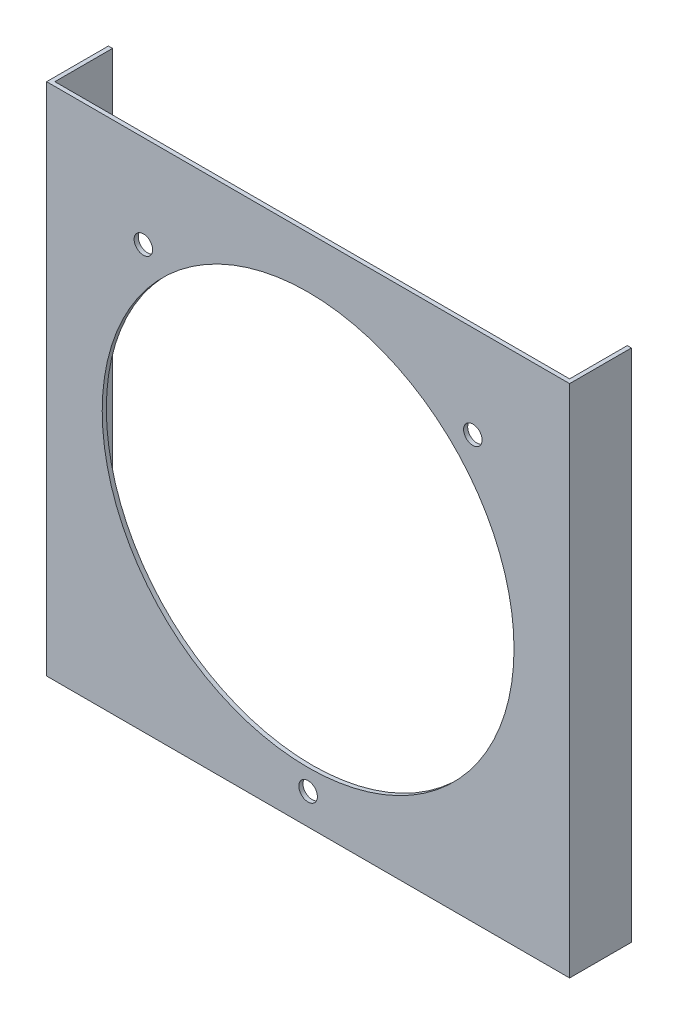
SolidWorks part; units mm, degrees
ref_plane "Piano frontale" through (0, 0, 0) normal (0, 0, 1) x (1, 0, 0)
ref_plane "Piano superiore" through (0, 0, 0) normal (0, 1, 0) x (1, 0, 0)
ref_plane "Piano destro" through (0, 0, 0) normal (1, 0, 0) x (0, 0, -1)
sketch "Schizzo1" plane through (0, 0, 0) normal (0, 0, 1) x (1, 0, 0)
  line L1 (-125, -125) -> (125, -125)
  line L2 (-125, -125) -> (-125, 125)
  line L3 (-125, 125) -> (125, 125)
  line L4 (125, -125) -> (125, 125)
  line L5 (-125, -125) -> (125, 125) construction
  line L6 (-125, 125) -> (125, -125) construction
  circle A1 centre (0, 0) radius 100
  circle A2 centre (-80, 80) radius 4.5
  circle A3 centre (80, 80) radius 4.5
  circle A4 centre (0, -110) radius 4.5
  point P0 (0, 0)
  dimension "D3" = 80
  dimension "D4" = 200
  dimension "D7" = 9
  dimension "D8" = 9
  dimension "D9" = 9
  dimension "D1" = 250
  dimension "D2" = 250
  dimension "D5" = 80
  dimension "D6" = 110
extrude "Estrusione-Estrusione1" add sketch "Schizzo1" along normal blind 2
sketch "Schizzo3" plane through (-125, 0, 0) normal (-1, 0, 0) x (0, 0, 1)
  line L0 (2, -125) -> (0, -125) construction
  line L1 (2, 125) -> (-28, 125)
  line L2 (2, 125) -> (2, -125)
  line L3 (2, -125) -> (-28, -125)
  line L4 (-28, 125) -> (-28, -125)
  dimension "D1" = 30
extrude "Estrusione-Estrusione2" add sketch "Schizzo3" along normal blind 2
ref_plane "Piano1" through (0, 0, 0) normal (1, 0, 0) x (0, 0, -1)
mirror "Specchia1" about plane through (0, 0, 0) normal (1, 0, 0) of "Estrusione-Estrusione2"
